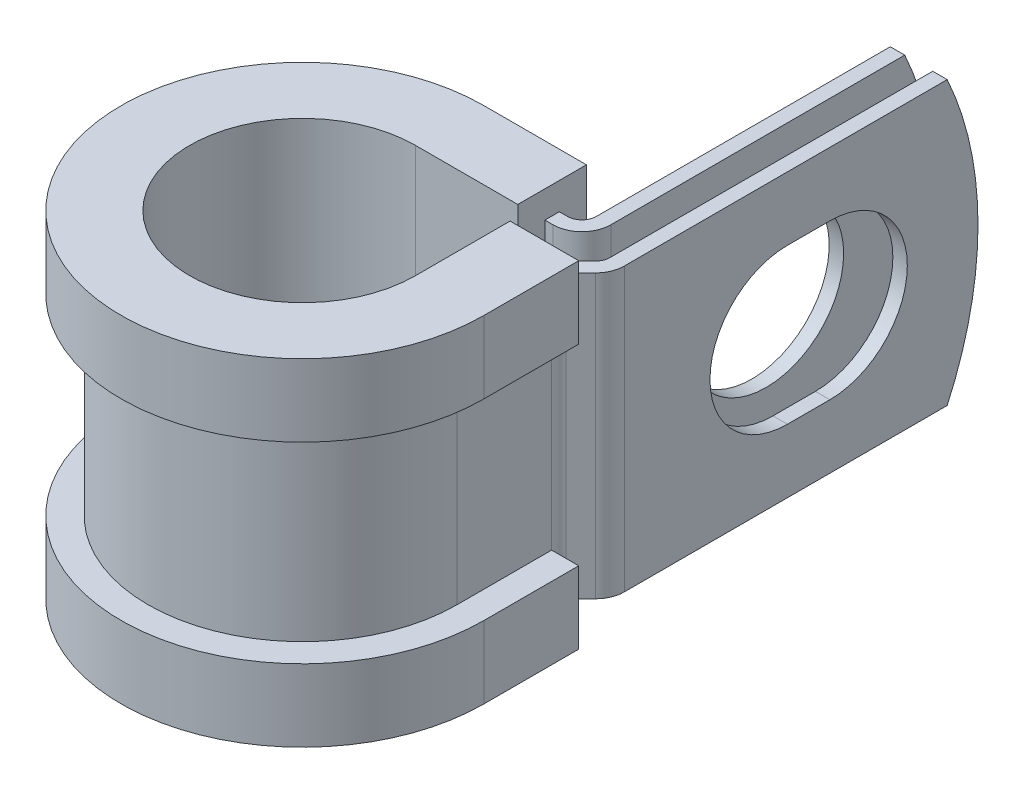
SolidWorks part; units mm, degrees
ref_plane "Front Plane" through (0, 0, 0) normal (0, 0, 1) x (1, 0, 0)
ref_plane "Top Plane" through (0, 0, 0) normal (0, 1, 0) x (1, 0, 0)
ref_plane "Right Plane" through (0, 0, 0) normal (1, 0, 0) x (0, 0, -1)
sketch "Sketch1" plane through (0, 0, 0) normal (0, 1, 0) x (1, 0, 0)
  line L0 (0, 7.874) -> (6.214, 7.874)
  line L1 (7.874, 0) -> (7.874, 5.3236)
  line L2 (7.8396, 27.7622) -> (7.8396, 9.4996)
  line L3 (8.3501, 6.4731) -> (9.1763, 7.2993)
  line L5 (9.4144, 7.874) -> (9.4144, 27.7622)
  arc A0 (0, 7.874) -> (7.874, 0) centre (0, 0) ccw
  arc A1 (8.3501, 6.4731) -> (7.874, 5.3236) centre (9.4996, 5.3236) ccw
  arc A2 (9.1763, 7.2993) -> (9.4144, 7.874) centre (8.6016, 7.874) ccw
  arc A3 (6.214, 7.874) -> (7.8396, 9.4996) centre (6.214, 9.4996) ccw
extrude "Extrude-Thin1" add sketch "Sketch1" along normal mid plane 15.875 thin
sketch "Sketch2" plane through (7.0268, 0, 0) normal (-1, 0, 0) x (0, 0, 1)
  line L0 (-27.7622, 7.9375) -> (-27.7622, -7.9375) construction
  line L1 (0, 7.9375) -> (0, -7.9375) construction
  circle A0 centre (-18.2372, 0) radius 4.3561
  point P2 (-27.7622, 0)
extrude "Cut-Extrude1" cut sketch "Sketch2" against normal up to surface (0.8128 mm away)
sketch "Sketch3" plane through (10.2272, 0, 0) normal (1, 0, 0) x (0, 0, -1)
  line L0 (17.0434, 0) -> (19.431, 0) construction
  line L1 (17.0434, 4.3561) -> (19.431, 4.3561)
  line L2 (17.0434, -4.3561) -> (19.431, -4.3561)
  line L3 (27.7622, 7.9375) -> (27.7622, -7.9375) construction
  arc A0 (17.0434, 4.3561) -> (17.0434, -4.3561) centre (17.0434, 0) ccw
  arc A1 (19.431, -4.3561) -> (19.431, 4.3561) centre (19.431, 0) ccw
  point P3 (18.2372, 0)
  point P8 (27.7622, 0)
  point P11 (12.6873, 0)
  point P12 (23.7871, 0)
extrude "Cut-Extrude2" cut sketch "Sketch3" against normal up to surface (0.8128 mm away)
sketch "Sketch4" plane through (7.0268, 0, 0) normal (-1, 0, 0) x (0, 0, 1)
  line L0 (-27.7622, 7.9375) -> (-27.7622, -7.9375)
  line L1 (-27.7622, 7.9375) -> (-26.0298, 7.9375)
  line L2 (-27.7622, 7.9375) -> (-9.4996, 7.9375) construction
  line L3 (-27.7622, -7.9375) -> (-26.0298, -7.9375)
  line L4 (-27.7622, -7.9375) -> (-9.4996, -7.9375) construction
  arc A0 (-26.0298, 7.9375) -> (-26.0298, -7.9375) centre (-8.7122, 0) ccw
extrude "Cut-Extrude3" cut sketch "Sketch4" against normal through all contours A0 M4 M5 | A0 L0 M2
ref_plane "Plane1" through (0, 0, -5.3236) normal (0, 0, -1) x (-1, 0, 0)
ref_plane "Plane2" through (5.7568, 0, 0) normal (-1, 0, 0) x (0, 0, 1)
sketch "Sketch5" plane through (0, 0, -5.3236) normal (0, 0, -1) x (-1, 0, 0)
  line L0 (-8.6868, 7.9375) -> (-7.874, 7.9375)
  line L1 (-8.6868, 7.9375) -> (-8.6868, -7.9375) construction
  line L3 (-7.874, 7.9375) -> (-7.874, -7.9375)
  line L4 (-7.874, -7.9375) -> (-8.6868, -7.9375)
  line L5 (-8.6868, -7.9375) -> (-8.6868, -5.3975)
  line L6 (-8.6868, 7.9375) -> (-8.6868, 5.3975)
  line L7 (-10.2108, 9.4615) -> (-10.2108, 5.3975)
  line L8 (-10.2108, 9.4615) -> (-6.35, 9.4615)
  line L9 (-6.35, 9.4615) -> (-6.35, -9.4615)
  line L10 (-6.35, -9.4615) -> (-10.2108, -9.4615)
  line L11 (-10.2108, -9.4615) -> (-10.2108, -5.3975)
  line L12 (-10.2108, 5.3975) -> (-8.6868, 5.3975)
  line L13 (-8.6868, -5.3975) -> (-10.2108, -5.3975)
sketch "Sketch6" plane through (0, 7.9375, 0) normal (0, 1, 0) x (1, 0, 0)
  line L0 (6.35, 0) -> (6.35, 5.3236)
  line L1 (6.35, 5.3236) -> (10.2108, 5.3236) construction
  line L2 (5.7568, 6.9878) -> (5.7568, -6.9878) construction
  line L5 (0, 6.35) -> (5.7568, 6.35)
  arc A0 (0, 6.35) -> (6.35, 0) centre (0, 0) ccw
sweep "Sweep1" add profiles "Sketch5" path "Sketch6"
equation "\"D4@Sketch5\" = \"D1@Extrude-Thin1\""
equation "\"D5@Sketch5\" = \"D5@Extrude-Thin1\""
equation "\"D1@Sketch3\" = \"D2@Sketch2\""
equation "\"D7@Sketch1\" = \"D3@Sketch2\" + \"D1@Sketch3\""
equation "\"D1@Sketch1\" = \"D1@Sketch6\" + 2 * \"D3@Sketch5\""
equation "\"D1@Sketch4\" = ( \"D1@Extrude-Thin1\" + .125 ) * 2"
equation "\"D9@Sketch1\"= \"D5@Extrude-Thin1\""
equation "\"D8@Sketch1\"= 2 * \"D5@Extrude-Thin1\""
equation "\"D2@Sketch1\" = 2 * \"D5@Extrude-Thin1\""
equation "\"D2@Sketch3\" = \"D1@Sketch2\""
